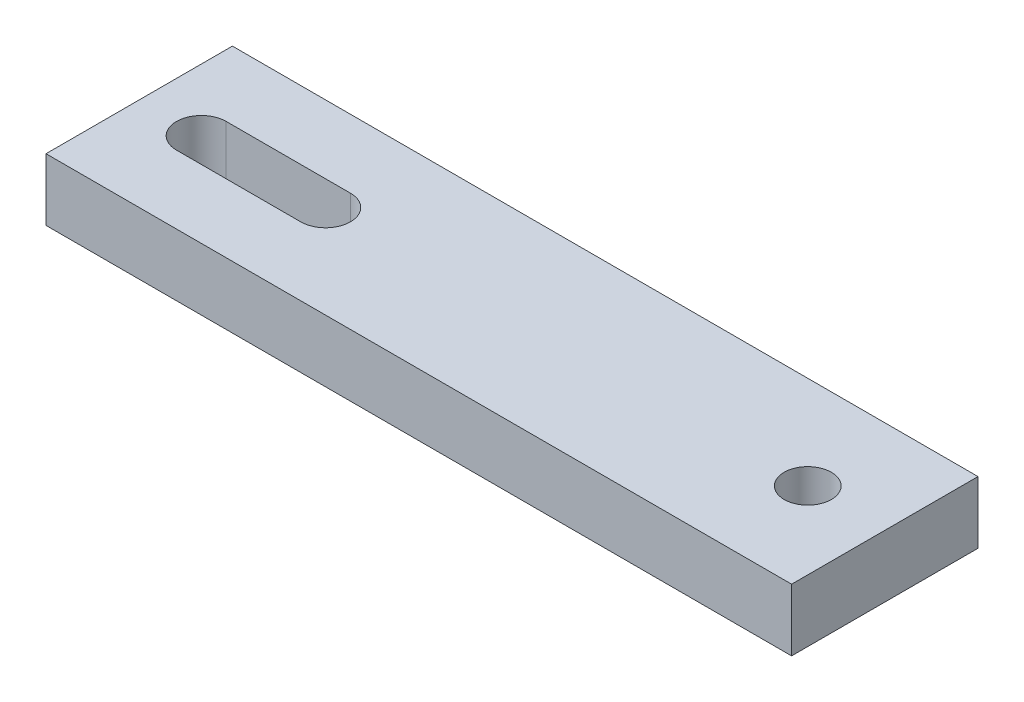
SolidWorks part; units mm, degrees
ref_plane "Front Plane" through (0, 0, 0) normal (0, 0, 1) x (1, 0, 0)
ref_plane "Top Plane" through (0, 0, 0) normal (0, 1, 0) x (1, 0, 0)
ref_plane "Right Plane" through (0, 0, 0) normal (1, 0, 0) x (0, 0, -1)
sketch "Sketch1" plane through (0, 0, 0) normal (0, 1, 0) x (1, 0, 0)
  line L1 (0, 0) -> (76.2, 0)
  line L2 (0, 0) -> (0, 19.05)
  line L3 (0, 19.05) -> (76.2, 19.05)
  line L4 (76.2, 0) -> (76.2, 19.05)
  dimension "D1" = 19.05
  dimension "D2" = 76.2
extrude "Extrude1" add sketch "Sketch1" along normal blind 6.35
sketch "Sketch2" plane through (0, 6.35, 0) normal (0, 1, 0) x (-1, 0, 0)
  line L0 (0, -19.05) -> (0, 0) construction
  line L1 (-6.35, -6.985) -> (-19.05, -6.985)
  line L2 (-6.35, -12.065) -> (-19.05, -12.065)
  arc A0 (-6.35, -12.065) -> (-6.35, -6.985) centre (-6.35, -9.525) ccw
  arc A1 (-19.05, -6.985) -> (-19.05, -12.065) centre (-19.05, -9.525) ccw
  dimension "D1" = 12.7
  dimension "D2" = 5.08
  dimension "D3" = 6.35
extrude "Cut-Extrude1" cut sketch "Sketch2" against normal through all
sketch "Sketch3" plane through (0, 6.35, 0) normal (0, 1, 0) x (-1, 0, 0)
  circle A1 centre (-6.35, -9.525) radius 2.54 construction
  point P0 (-68.326, -9.525)
  dimension "D1" = 61.976
hole_wizard "#10-24 Tapped Hole1" positions "3DSketch1" profile "Sketch4" tap size "#10-24" standard "Ansi Inch"
sketch3d "3DSketch1"
  point P0 (68.326, 6.35, -9.525)
sketch "Sketch4" plane through (68.326, 6.35, -9.525) normal (1, 0, 0) x (0, 0, 1)
  line L0 (0, 0) -> (0, 6.35)
  line L1 (0, 6.35) -> (2.413, 6.35)
  line L2 (2.413, 6.35) -> (2.413, 0)
  line L5 (2.413, 0) -> (0, 0)
  line L11 (0, -6.35) -> (0, 107.95) construction
  dimension "Thread Major Dia." = 4.826
  dimension "Thru Tap Drill Depth" = 6.35
